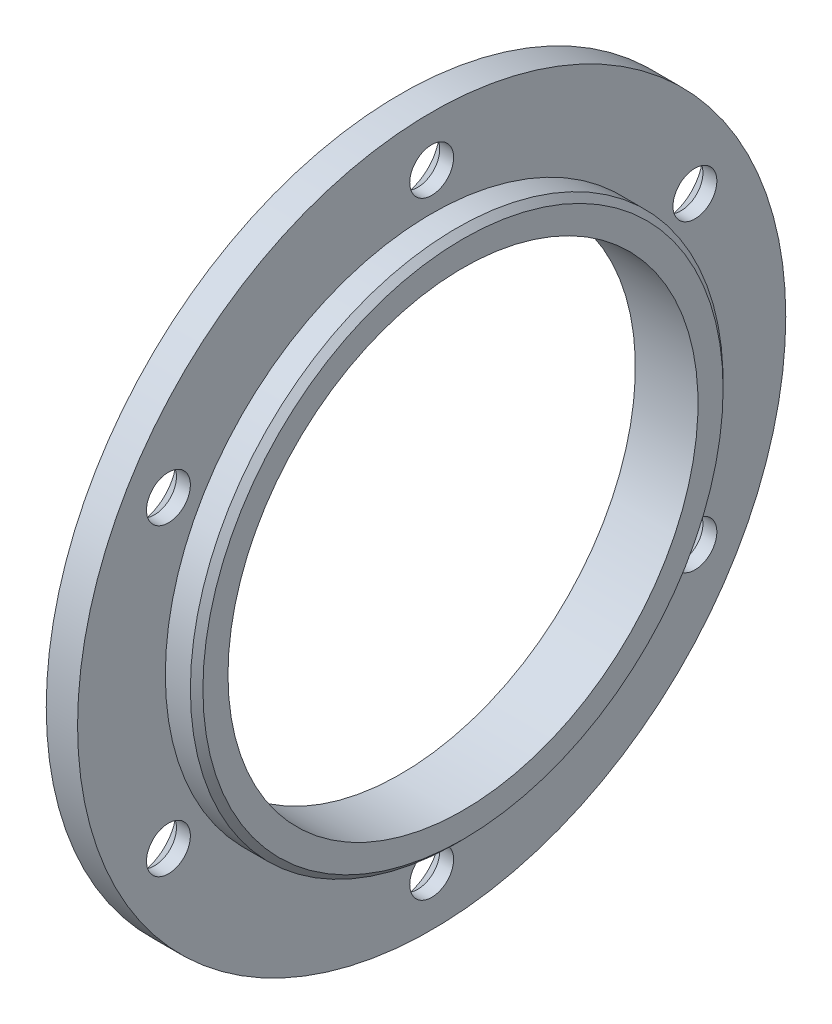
SolidWorks part; units mm, degrees
ref_plane "Plan de face" through (0, 0, 0) normal (0, 0, 1) x (1, 0, 0)
ref_plane "Plan de dessus" through (0, 0, 0) normal (0, 1, 0) x (1, 0, 0)
ref_plane "Plan de droite" through (0, 0, 0) normal (1, 0, 0) x (0, 0, -1)
sketch "Esquisse1" plane through (0, 0, 0) normal (0, 0, 1) x (1, 0, 0)
  line L0 (5, 42.5) -> (5, 56.5)
  line L1 (0, 56.5) -> (5, 56.5)
  line L2 (0, 37.5) -> (0, 56.5)
  line L3 (9, 42.5) -> (10, 41.5)
  line L4 (10, 41.5) -> (10, 37.5)
  line L5 (10, 37.5) -> (0, 37.5)
  line L6 (-20.4244, 0) -> (67.171, 0) construction
  line L7 (5, 42.5) -> (9, 42.5)
  point P7 (10, 42.5)
  dimension "D1" = 56.5
  dimension "D2" = 37.5
  dimension "D3" = 1
  dimension "D4" = 45
  dimension "D7" = 42.5
revolve "Révolution1" add sketch "Esquisse1" angle 360 about L6
sketch "Esquisse3" plane through (0, 0, 0) normal (-1, 0, 0) x (0, 0, 1)
  line L0 (0, 61.6516) -> (0, -61.6516) construction
  circle A0 centre (0, 0) radius 48.5 construction
  circle A1 centre (0, 48.5) radius 3.5
  circle A2 centre (42.0022, 24.25) radius 3.5
  circle A3 centre (42.0022, -24.25) radius 3.5
  circle A4 centre (0, -48.5) radius 3.5
  circle A5 centre (-42.0022, -24.25) radius 3.5
  circle A6 centre (-42.0022, 24.25) radius 3.5
  dimension "D1" = 97
  dimension "D2" = 7
extrude "Extrusion2" cut sketch "Esquisse3" against normal blind 9
chamfer "Chanfrein1" distance 2.78 angle 45 6 edges at (0, 24.25, 45.5022) (0, 48.5, 3.5) (0, 24.25, -38.5022) (0, -24.25, -38.5022) (0, -24.25, 45.5022) (0, -48.5, 3.5)
